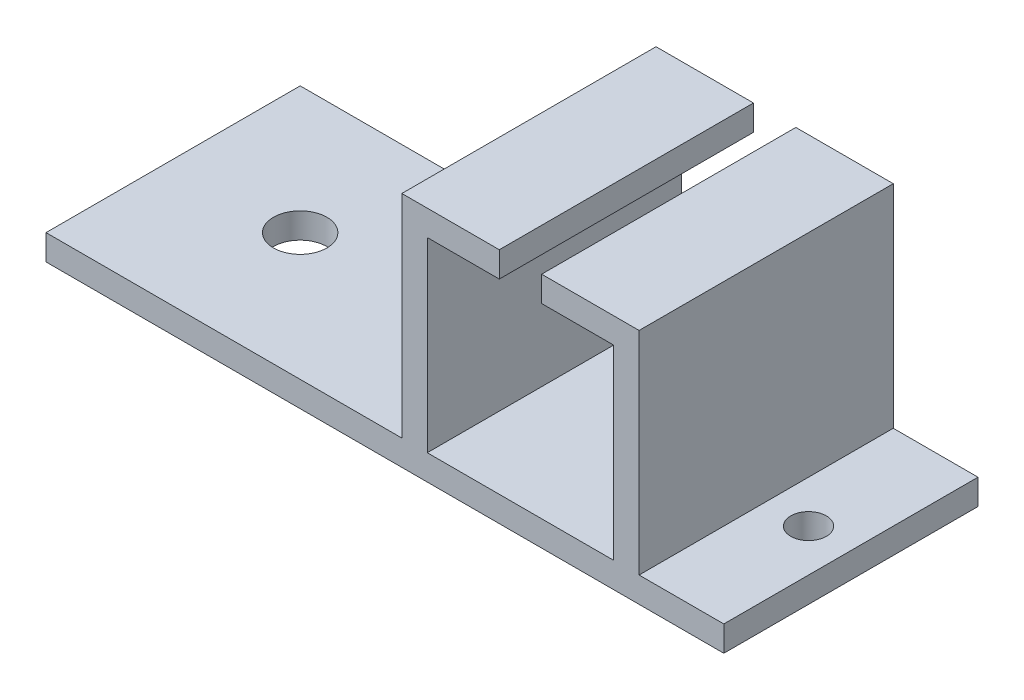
SolidWorks part; units mm, degrees
ref_plane "Front Plane" through (0, 0, 0) normal (0, 0, 1) x (1, 0, 0)
ref_plane "Top Plane" through (0, 0, 0) normal (0, 1, 0) x (1, 0, 0)
ref_plane "Right Plane" through (0, 0, 0) normal (1, 0, 0) x (0, 0, -1)
sketch "Sketch3" plane through (0, 0, 0) normal (0, 0, 1) x (1, 0, 0)
  line L1 (-40, 1.5) -> (40, 1.5)
  line L2 (-40, 1.5) -> (-40, -1.5)
  line L3 (-40, -1.5) -> (40, -1.5)
  line L4 (40, 1.5) -> (40, -1.5)
  line L5 (-40, 1.5) -> (40, -1.5) construction
  line L6 (-40, -1.5) -> (40, 1.5) construction
  point P0 (0, 0)
  dimension "D1" = 80
  dimension "D2" = 3
extrude "Boss-Extrude1" add sketch "Sketch3" along normal mid plane 30
sketch "Sketch4" plane through (0, 1.5, 0) normal (0, 1, 0) x (1, 0, 0)
  line L0 (40, -15) -> (-40, -15) construction
  line L1 (2, 15) -> (30, 15)
  line L2 (2, 15) -> (2, -15)
  line L3 (2, -15) -> (30, -15)
  line L4 (30, 15) -> (30, -15)
  line L5 (2, 15) -> (30, -15) construction
  line L6 (2, -15) -> (30, 15) construction
  line L8 (40, -15) -> (40, 15) construction
  point P0 (16, 0)
  dimension "D1" = 28
  dimension "D2" = 10
extrude "Boss-Extrude2" add sketch "Sketch4" along normal blind 25
sketch "Sketch5" plane through (0, 0, 15) normal (0, 0, 1) x (1, 0, 0)
  line L0 (2, 26.5) -> (2, 1.5) construction
  line L1 (5, 23.5) -> (27, 23.5)
  line L2 (5, 23.5) -> (5, 1.5)
  line L3 (5, 1.5) -> (27, 1.5)
  line L4 (27, 23.5) -> (27, 1.5)
  line L5 (2, 26.5) -> (30, 26.5) construction
  line L6 (30, 26.5) -> (30, 1.5) construction
  line L7 (-40, -1.5) -> (40, -1.5) construction
  dimension "D1" = 3
  dimension "D2" = 3
  dimension "D3" = 3
  dimension "D4" = 3
extrude "Cut-Extrude1" cut sketch "Sketch5" against normal through all
sketch "Sketch6" plane through (0, 1.5, 0) normal (0, 1, 0) x (1, 0, 0)
  line L0 (-15.4, 0) -> (15.4, 0) construction
  line L1 (40, -15) -> (40, 15) construction
  circle A0 centre (35, 0) radius 2.1
  dimension "D1" = 4.2
  dimension "D2" = 5
extrude "Cut-Extrude2" cut sketch "Sketch6" against normal through all
sketch "Sketch7" plane through (0, 1.5, 0) normal (0, 1, 0) x (1, 0, 0)
  line L0 (-15.4, 0) -> (15.4, 0) construction
  circle A0 centre (-25, 0) radius 3.15
  circle A1 centre (35, 0) radius 2.1 construction
  dimension "D1" = 6.3
  dimension "D2" = 60
extrude "Cut-Extrude3" cut sketch "Sketch7" against normal through all
sketch "Sketch8" plane through (0, 26.5, 0) normal (0, 1, 0) x (1, 0, 0)
  line L0 (18.5, 15) -> (18.5, -15)
  line L1 (2, -15) -> (30, -15) construction
  line L2 (30, 15) -> (2, 15) construction
  line L3 (16, 15) -> (18.5, 15)
  line L4 (16, -15) -> (13.5, -15)
  line L5 (18.5, -15) -> (16, -15)
  line L6 (16, 15) -> (13.5, 15)
  line L7 (13.5, 15) -> (13.5, -15)
  dimension "D1" = 2.5
  dimension "D2" = 2.5
extrude "Cut-Extrude4" cut sketch "Sketch8" against normal blind 10
